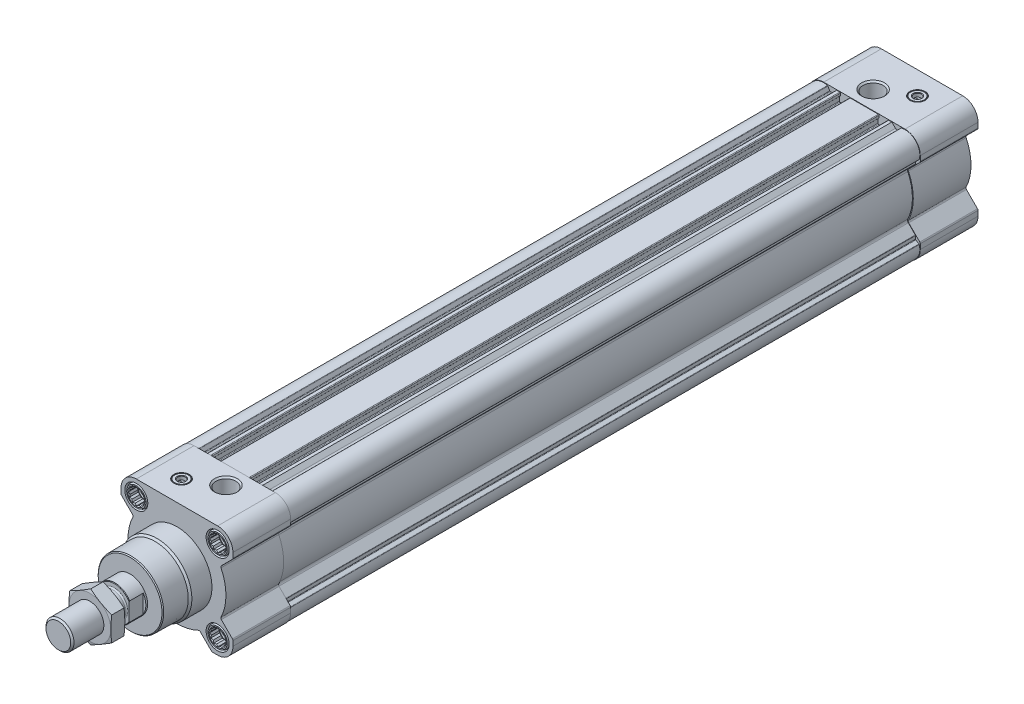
SolidWorks part; units mm, degrees
ref_plane "Plano frontal" through (0, 0, 0) normal (0, 0, 1) x (1, 0, 0)
ref_plane "Plano superior" through (0, 0, 0) normal (0, 1, 0) x (1, 0, 0)
ref_plane "Plano direito" through (0, 0, 0) normal (1, 0, 0) x (0, 0, -1)
imported_body "1"
imported_body "2"
imported_body "3"
sketch "Esboço1" plane through (0, 0, 0) normal (1, 0, 0) x (0, 0, -1)
  line L1 (119.4878, -60.15) -> (142.4481, -60.15)
  line L2 (119.4878, -60.15) -> (119.4878, 47.1762)
  line L3 (119.4878, 47.1762) -> (142.4481, 47.1762)
  line L4 (142.4481, -60.15) -> (142.4481, 47.1762)
extrude "Corte-extrusão1" cut sketch "Esboço1" against normal through all both and the other way through all
move or copy body "Corpo-Mover/Copiar1" bodies to move or copy 107 101 106 copy no translate (0, 0, 20)
sketch "Esboço2" plane through (0, 0, -142.4481) normal (0, 0, 1) x (1, 0, 0)
  circle A1 centre (0, 0) radius 10
  circle A2 centre (0, 0) radius 10
  dimension "D1" = 0
extrude "Ressalto-extrusão1" add sketch "Esboço2" along normal blind 76
sketch "Esboço3" plane through (0, 0, -142.4481) normal (0, 0, 1) x (1, 0, 0)
  line L82 (-19.4691, -29.25) -> (-17.7484, -29.25)
  line L83 (-17.4656, -29.1328) -> (-13.4788, -25.146)
  line L84 (13.4788, -25.146) -> (17.4656, -29.1328)
  line L85 (17.7484, -29.25) -> (19.4691, -29.25)
  line L86 (19.8155, -29.45) -> (20.8477, -31.2378)
  line L87 (31.2378, -20.8477) -> (29.45, -19.8155)
  line L88 (29.25, -19.4691) -> (29.25, -17.7484)
  line L89 (29.1328, -17.4656) -> (25.146, -13.4788)
  line L90 (25.146, 13.4788) -> (29.1328, 17.4656)
  line L91 (29.25, 17.7484) -> (29.25, 19.4691)
  line L92 (29.45, 19.8155) -> (31.2378, 20.8477)
  line L93 (20.8477, 31.2378) -> (19.8155, 29.45)
  line L94 (19.4691, 29.25) -> (18.8713, 29.25)
  line L95 (17.8107, 29.6893) -> (15.75, 31.75)
  line L96 (15.75, 31.75) -> (14, 31.75)
  line L97 (13.6, 31.35) -> (13.6, 30.15)
  line L98 (13.8, 29.95) -> (14.05, 29.95)
  line L99 (14.25, 29.75) -> (14.25, 27.15)
  line L100 (13.85, 26.75) -> (8.15, 26.75)
  line L101 (7.75, 27.15) -> (7.75, 29.75)
  line L102 (7.95, 29.95) -> (8.2, 29.95)
  line L103 (8.4, 30.15) -> (8.4, 31.35)
  line L104 (8, 31.75) -> (-8, 31.75)
  line L105 (-8.4, 31.35) -> (-8.4, 30.15)
  line L106 (-8.2, 29.95) -> (-7.95, 29.95)
  line L107 (-7.75, 29.75) -> (-7.75, 27.15)
  line L108 (-8.15, 26.75) -> (-13.85, 26.75)
  line L109 (-14.25, 27.15) -> (-14.25, 29.75)
  line L110 (-14.05, 29.95) -> (-13.8, 29.95)
  line L111 (-13.6, 30.15) -> (-13.6, 31.35)
  line L112 (-14, 31.75) -> (-15.75, 31.75)
  line L113 (-15.75, 31.75) -> (-17.8107, 29.6893)
  line L114 (-18.8713, 29.25) -> (-19.4691, 29.25)
  line L115 (-19.8155, 29.45) -> (-20.8477, 31.2378)
  line L116 (-31.2378, 20.8477) -> (-29.45, 19.8155)
  line L117 (-29.25, 19.4691) -> (-29.25, 17.7484)
  line L118 (-29.1328, 17.4656) -> (-25.146, 13.4788)
  line L119 (-25.146, -13.4788) -> (-29.1328, -17.4656)
  line L120 (-29.25, -17.7484) -> (-29.25, -19.4691)
  line L121 (-29.45, -19.8155) -> (-31.2378, -20.8477)
  line L122 (-20.8477, -31.2378) -> (-19.8155, -29.45)
  line L123 (-19.4691, -29.25) -> (-17.7484, -29.25)
  line L124 (-17.4656, -29.1328) -> (-13.4788, -25.146)
  line L125 (13.4788, -25.146) -> (17.4656, -29.1328)
  line L126 (17.7484, -29.25) -> (19.4691, -29.25)
  line L127 (19.8155, -29.45) -> (20.8477, -31.2378)
  line L128 (31.2378, -20.8477) -> (29.45, -19.8155)
  line L129 (29.25, -19.4691) -> (29.25, -17.7484)
  line L130 (29.1328, -17.4656) -> (25.146, -13.4788)
  line L131 (25.146, 13.4788) -> (29.1328, 17.4656)
  line L132 (29.25, 17.7484) -> (29.25, 19.4691)
  line L133 (29.45, 19.8155) -> (31.2378, 20.8477)
  line L134 (20.8477, 31.2378) -> (19.8155, 29.45)
  line L135 (19.4691, 29.25) -> (18.8713, 29.25)
  line L136 (17.8107, 29.6893) -> (15.75, 31.75)
  line L137 (15.75, 31.75) -> (14, 31.75)
  line L138 (13.6, 31.35) -> (13.6, 30.15)
  line L139 (13.8, 29.95) -> (14.05, 29.95)
  line L140 (14.25, 29.75) -> (14.25, 27.15)
  line L141 (13.85, 26.75) -> (8.15, 26.75)
  line L142 (7.75, 27.15) -> (7.75, 29.75)
  line L143 (7.95, 29.95) -> (8.2, 29.95)
  line L144 (8.4, 30.15) -> (8.4, 31.35)
  line L145 (8, 31.75) -> (-8, 31.75)
  line L146 (-8.4, 31.35) -> (-8.4, 30.15)
  line L147 (-8.2, 29.95) -> (-7.95, 29.95)
  line L148 (-7.75, 29.75) -> (-7.75, 27.15)
  line L149 (-8.15, 26.75) -> (-13.85, 26.75)
  line L150 (-14.25, 27.15) -> (-14.25, 29.75)
  line L151 (-14.05, 29.95) -> (-13.8, 29.95)
  line L152 (-13.6, 30.15) -> (-13.6, 31.35)
  line L153 (-14, 31.75) -> (-15.75, 31.75)
  line L154 (-15.75, 31.75) -> (-17.8107, 29.6893)
  line L155 (-18.8713, 29.25) -> (-19.4691, 29.25)
  line L156 (-19.8155, 29.45) -> (-20.8477, 31.2378)
  line L157 (-31.2378, 20.8477) -> (-29.45, 19.8155)
  line L158 (-29.25, 19.4691) -> (-29.25, 17.7484)
  line L159 (-29.1328, 17.4656) -> (-25.146, 13.4788)
  line L160 (-25.146, -13.4788) -> (-29.1328, -17.4656)
  line L161 (-29.25, -17.7484) -> (-29.25, -19.4691)
  line L162 (-29.45, -19.8155) -> (-31.2378, -20.8477)
  line L163 (-20.8477, -31.2378) -> (-19.8155, -29.45)
  circle A53 centre (0, 0) radius 25 construction
  circle A54 centre (0, 0) radius 25
  arc A106 (-17.7484, -29.25) -> (-17.4656, -29.1328) centre (-17.7484, -28.85) ccw
  arc A107 (-11.7758, -24.8512) -> (-13.4788, -25.146) centre (-12.4181, -26.2067) ccw
  arc A108 (-11.7758, -24.8512) -> (11.7758, -24.8512) centre (0, 0) ccw
  arc A109 (13.4788, -25.146) -> (11.7758, -24.8512) centre (12.4181, -26.2067) ccw
  arc A110 (17.4656, -29.1328) -> (17.7484, -29.25) centre (17.7484, -28.85) ccw
  arc A111 (19.8155, -29.45) -> (19.4691, -29.25) centre (19.4691, -29.65) ccw
  arc A112 (20.8477, -31.2378) -> (21.0831, -31.4221) centre (21.1941, -31.0378) ccw
  arc A113 (21.0831, -31.4221) -> (31.4221, -21.0831) centre (23.4, -23.4) ccw
  arc A114 (31.4221, -21.0831) -> (31.2378, -20.8477) centre (31.0378, -21.1941) ccw
  arc A115 (29.25, -19.4691) -> (29.45, -19.8155) centre (29.65, -19.4691) ccw
  arc A116 (29.25, -17.7484) -> (29.1328, -17.4656) centre (28.85, -17.7484) ccw
  arc A117 (24.8512, -11.7758) -> (25.146, -13.4788) centre (26.2067, -12.4181) ccw
  arc A118 (24.8512, -11.7758) -> (24.8512, 11.7758) centre (0, 0) ccw
  arc A119 (25.146, 13.4788) -> (24.8512, 11.7758) centre (26.2067, 12.4181) ccw
  arc A120 (29.1328, 17.4656) -> (29.25, 17.7484) centre (28.85, 17.7484) ccw
  arc A121 (29.45, 19.8155) -> (29.25, 19.4691) centre (29.65, 19.4691) ccw
  arc A122 (31.2378, 20.8477) -> (31.4221, 21.0831) centre (31.0378, 21.1941) ccw
  arc A123 (31.4221, 21.0831) -> (21.0831, 31.4221) centre (23.4, 23.4) ccw
  arc A124 (21.0831, 31.4221) -> (20.8477, 31.2378) centre (21.1941, 31.0378) ccw
  arc A125 (19.4691, 29.25) -> (19.8155, 29.45) centre (19.4691, 29.65) ccw
  arc A126 (17.8107, 29.6893) -> (18.8713, 29.25) centre (18.8713, 30.75) ccw
  arc A127 (14, 31.75) -> (13.6, 31.35) centre (14, 31.35) ccw
  arc A128 (13.6, 30.15) -> (13.8, 29.95) centre (13.8, 30.15) ccw
  arc A129 (14.25, 29.75) -> (14.05, 29.95) centre (14.05, 29.75) ccw
  arc A130 (13.85, 26.75) -> (14.25, 27.15) centre (13.85, 27.15) ccw
  arc A131 (7.75, 27.15) -> (8.15, 26.75) centre (8.15, 27.15) ccw
  arc A132 (7.95, 29.95) -> (7.75, 29.75) centre (7.95, 29.75) ccw
  arc A133 (8.2, 29.95) -> (8.4, 30.15) centre (8.2, 30.15) ccw
  arc A134 (8.4, 31.35) -> (8, 31.75) centre (8, 31.35) ccw
  arc A135 (-8, 31.75) -> (-8.4, 31.35) centre (-8, 31.35) ccw
  arc A136 (-8.4, 30.15) -> (-8.2, 29.95) centre (-8.2, 30.15) ccw
  arc A137 (-7.75, 29.75) -> (-7.95, 29.95) centre (-7.95, 29.75) ccw
  arc A138 (-8.15, 26.75) -> (-7.75, 27.15) centre (-8.15, 27.15) ccw
  arc A139 (-14.25, 27.15) -> (-13.85, 26.75) centre (-13.85, 27.15) ccw
  arc A140 (-14.05, 29.95) -> (-14.25, 29.75) centre (-14.05, 29.75) ccw
  arc A141 (-13.8, 29.95) -> (-13.6, 30.15) centre (-13.8, 30.15) ccw
  arc A142 (-13.6, 31.35) -> (-14, 31.75) centre (-14, 31.35) ccw
  arc A143 (-18.8713, 29.25) -> (-17.8107, 29.6893) centre (-18.8713, 30.75) ccw
  arc A144 (-19.8155, 29.45) -> (-19.4691, 29.25) centre (-19.4691, 29.65) ccw
  arc A145 (-20.8477, 31.2378) -> (-21.0831, 31.4221) centre (-21.1941, 31.0378) ccw
  arc A146 (-21.0831, 31.4221) -> (-31.4221, 21.0831) centre (-23.4, 23.4) ccw
  arc A147 (-31.4221, 21.0831) -> (-31.2378, 20.8477) centre (-31.0378, 21.1941) ccw
  arc A148 (-29.25, 19.4691) -> (-29.45, 19.8155) centre (-29.65, 19.4691) ccw
  arc A149 (-29.25, 17.7484) -> (-29.1328, 17.4656) centre (-28.85, 17.7484) ccw
  arc A150 (-24.8512, 11.7758) -> (-25.146, 13.4788) centre (-26.2067, 12.4181) ccw
  arc A151 (-24.8512, 11.7758) -> (-24.8512, -11.7758) centre (0, 0) ccw
  arc A152 (-25.146, -13.4788) -> (-24.8512, -11.7758) centre (-26.2067, -12.4181) ccw
  arc A153 (-29.1328, -17.4656) -> (-29.25, -17.7484) centre (-28.85, -17.7484) ccw
  arc A154 (-29.45, -19.8155) -> (-29.25, -19.4691) centre (-29.65, -19.4691) ccw
  arc A155 (-31.2378, -20.8477) -> (-31.4221, -21.0831) centre (-31.0378, -21.1941) ccw
  arc A156 (-31.4221, -21.0831) -> (-21.0831, -31.4221) centre (-23.4, -23.4) ccw
  arc A157 (-21.0831, -31.4221) -> (-20.8477, -31.2378) centre (-21.1941, -31.0378) ccw
  arc A158 (-19.4691, -29.25) -> (-19.8155, -29.45) centre (-19.4691, -29.65) ccw
  arc A159 (-17.7484, -29.25) -> (-17.4656, -29.1328) centre (-17.7484, -28.85) ccw
  arc A160 (-11.7758, -24.8512) -> (-13.4788, -25.146) centre (-12.4181, -26.2067) ccw
  arc A161 (-11.7758, -24.8512) -> (11.7758, -24.8512) centre (0, 0) ccw
  arc A162 (13.4788, -25.146) -> (11.7758, -24.8512) centre (12.4181, -26.2067) ccw
  arc A163 (17.4656, -29.1328) -> (17.7484, -29.25) centre (17.7484, -28.85) ccw
  arc A164 (19.8155, -29.45) -> (19.4691, -29.25) centre (19.4691, -29.65) ccw
  arc A165 (20.8477, -31.2378) -> (21.0831, -31.4221) centre (21.1941, -31.0378) ccw
  arc A166 (21.0831, -31.4221) -> (31.4221, -21.0831) centre (23.4, -23.4) ccw
  arc A167 (31.4221, -21.0831) -> (31.2378, -20.8477) centre (31.0378, -21.1941) ccw
  arc A168 (29.25, -19.4691) -> (29.45, -19.8155) centre (29.65, -19.4691) ccw
  arc A169 (29.25, -17.7484) -> (29.1328, -17.4656) centre (28.85, -17.7484) ccw
  arc A170 (24.8512, -11.7758) -> (25.146, -13.4788) centre (26.2067, -12.4181) ccw
  arc A171 (24.8512, -11.7758) -> (24.8512, 11.7758) centre (0, 0) ccw
  arc A172 (25.146, 13.4788) -> (24.8512, 11.7758) centre (26.2067, 12.4181) ccw
  arc A173 (29.1328, 17.4656) -> (29.25, 17.7484) centre (28.85, 17.7484) ccw
  arc A174 (29.45, 19.8155) -> (29.25, 19.4691) centre (29.65, 19.4691) ccw
  arc A175 (31.2378, 20.8477) -> (31.4221, 21.0831) centre (31.0378, 21.1941) ccw
  arc A176 (31.4221, 21.0831) -> (21.0831, 31.4221) centre (23.4, 23.4) ccw
  arc A177 (21.0831, 31.4221) -> (20.8477, 31.2378) centre (21.1941, 31.0378) ccw
  arc A178 (19.4691, 29.25) -> (19.8155, 29.45) centre (19.4691, 29.65) ccw
  arc A179 (17.8107, 29.6893) -> (18.8713, 29.25) centre (18.8713, 30.75) ccw
  arc A180 (14, 31.75) -> (13.6, 31.35) centre (14, 31.35) ccw
  arc A181 (13.6, 30.15) -> (13.8, 29.95) centre (13.8, 30.15) ccw
  arc A182 (14.25, 29.75) -> (14.05, 29.95) centre (14.05, 29.75) ccw
  arc A183 (13.85, 26.75) -> (14.25, 27.15) centre (13.85, 27.15) ccw
  arc A184 (7.75, 27.15) -> (8.15, 26.75) centre (8.15, 27.15) ccw
  arc A185 (7.95, 29.95) -> (7.75, 29.75) centre (7.95, 29.75) ccw
  arc A186 (8.2, 29.95) -> (8.4, 30.15) centre (8.2, 30.15) ccw
  arc A187 (8.4, 31.35) -> (8, 31.75) centre (8, 31.35) ccw
  arc A188 (-8, 31.75) -> (-8.4, 31.35) centre (-8, 31.35) ccw
  arc A189 (-8.4, 30.15) -> (-8.2, 29.95) centre (-8.2, 30.15) ccw
  arc A190 (-7.75, 29.75) -> (-7.95, 29.95) centre (-7.95, 29.75) ccw
  arc A191 (-8.15, 26.75) -> (-7.75, 27.15) centre (-8.15, 27.15) ccw
  arc A192 (-14.25, 27.15) -> (-13.85, 26.75) centre (-13.85, 27.15) ccw
  arc A193 (-14.05, 29.95) -> (-14.25, 29.75) centre (-14.05, 29.75) ccw
  arc A194 (-13.8, 29.95) -> (-13.6, 30.15) centre (-13.8, 30.15) ccw
  arc A195 (-13.6, 31.35) -> (-14, 31.75) centre (-14, 31.35) ccw
  arc A196 (-18.8713, 29.25) -> (-17.8107, 29.6893) centre (-18.8713, 30.75) ccw
  arc A197 (-19.8155, 29.45) -> (-19.4691, 29.25) centre (-19.4691, 29.65) ccw
  arc A198 (-20.8477, 31.2378) -> (-21.0831, 31.4221) centre (-21.1941, 31.0378) ccw
  arc A199 (-21.0831, 31.4221) -> (-31.4221, 21.0831) centre (-23.4, 23.4) ccw
  arc A200 (-31.4221, 21.0831) -> (-31.2378, 20.8477) centre (-31.0378, 21.1941) ccw
  arc A201 (-29.25, 19.4691) -> (-29.45, 19.8155) centre (-29.65, 19.4691) ccw
  arc A202 (-29.25, 17.7484) -> (-29.1328, 17.4656) centre (-28.85, 17.7484) ccw
  arc A203 (-24.8512, 11.7758) -> (-25.146, 13.4788) centre (-26.2067, 12.4181) ccw
  arc A204 (-24.8512, 11.7758) -> (-24.8512, -11.7758) centre (0, 0) ccw
  arc A205 (-25.146, -13.4788) -> (-24.8512, -11.7758) centre (-26.2067, -12.4181) ccw
  arc A206 (-29.1328, -17.4656) -> (-29.25, -17.7484) centre (-28.85, -17.7484) ccw
  arc A207 (-29.45, -19.8155) -> (-29.25, -19.4691) centre (-29.65, -19.4691) ccw
  arc A208 (-31.2378, -20.8477) -> (-31.4221, -21.0831) centre (-31.0378, -21.1941) ccw
  arc A209 (-31.4221, -21.0831) -> (-21.0831, -31.4221) centre (-23.4, -23.4) ccw
  arc A210 (-21.0831, -31.4221) -> (-20.8477, -31.2378) centre (-21.1941, -31.0378) ccw
  arc A211 (-19.4691, -29.25) -> (-19.8155, -29.45) centre (-19.4691, -29.65) ccw
  dimension "D1" = 0
extrude "Ressalto-extrusão2" add sketch "Esboço3" along normal blind 76
